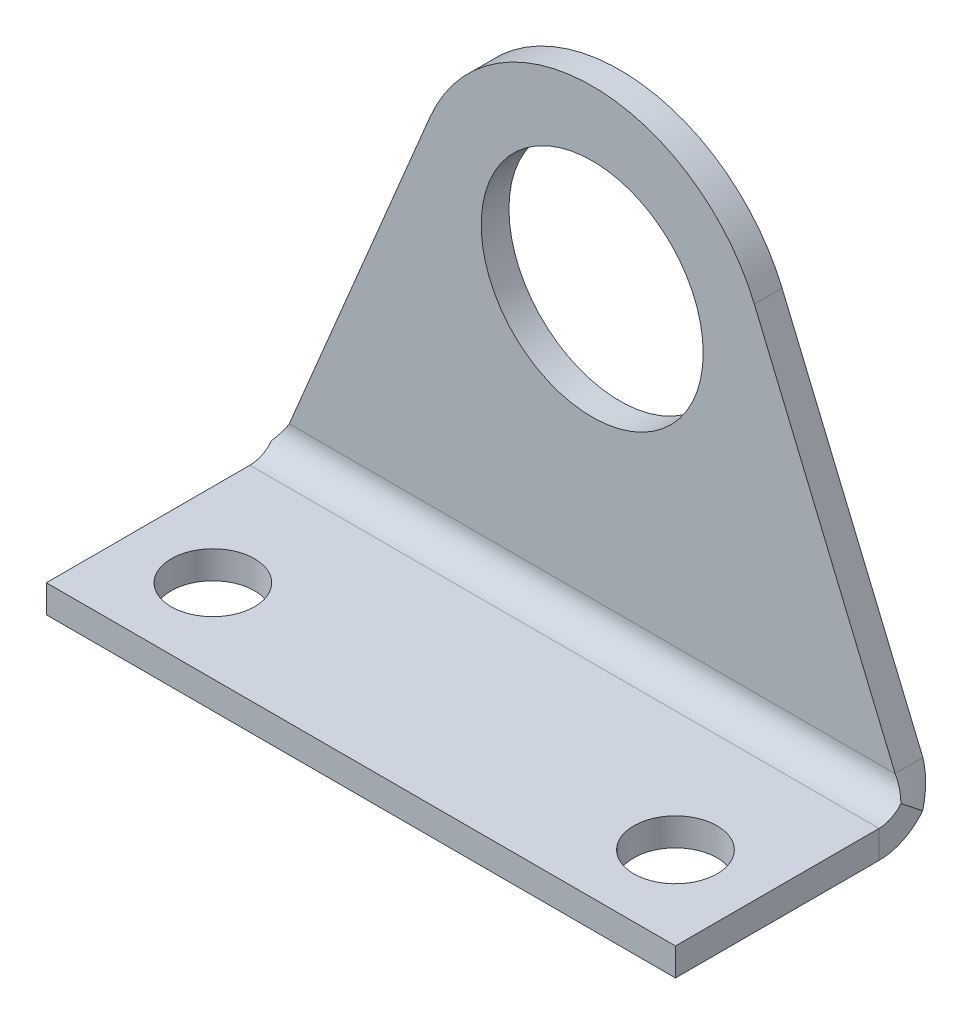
SolidWorks part; units mm, degrees
ref_plane "Plan1" through (0, 0, 0) normal (0, 0, 1) x (1, 0, 0)
ref_plane "Plan2" through (0, 0, 0) normal (0, 1, 0) x (1, 0, 0)
ref_plane "Plan3" through (0, 0, 0) normal (1, 0, 0) x (0, 0, -1)
sketch "Eflan" plane through (0, 0, 0) normal (0, 0, 1) x (1, 0, 0)
  line L0 (-8.7626, 19.6697) -> (-17, 0)
  line L1 (-17, 0) -> (17, 0)
  line L2 (17, 0) -> (8.7626, 19.6697)
  line L3 (0, 25.5) -> (17, 25.5) construction
  line L4 (0, 0) -> (0, 25.5) construction
  arc A0 (-8.7626, 19.6697) -> (8.7626, 19.6697) centre (0, 16) cw
  dimension "US" = 34
  dimension "NH" = 16
  dimension "H1" = 25.5
extrude "Flan" add sketch "Eflan" along normal blind 1.5
sketch "Eembase" plane through (0, 0, 0) normal (0, 0, -1) x (-1, 0, 0)
  line L1 (17, 0) -> (-17, 0)
  line L2 (17, 0) -> (17, -1.5)
  line L3 (17, -1.5) -> (-17, -1.5)
  line L4 (-17, 0) -> (-17, -1.5)
extrude "Embase" add sketch "Eembase" against normal blind 14
sheet metal parameters "Tôlerie 6"
bend "Pli dans angle1" bend angle 90 parameters "D1"=0, "D5"=1
flatten bends "Dépliage 7" parameters "D1"=0
sketch "Esquisse-Angle7" plane through (0, 0, 0) normal (0, 1, 0) x (-1, 0, 0)
  line L0 (-17, 1.2329) -> (17, 1.2329) construction
process bends "Pliage 7" parameters "D1"=0
sketch "Esquisse-Plate7" plane through (0, 0, 0) normal (0, 1, 0) x (-1, 0, 0)
sketch "Dnezvérin" plane through (0, 0, 1.5) normal (0, 0, 1) x (1, 0, 0)
  circle A0 centre (0, 16) radius 6
  arc A1 (8.7626, 19.6697) -> (-8.7626, 19.6697) centre (0, 16) ccw construction
  dimension "D2" = 12
extrude "Percage vérin" cut sketch "Dnezvérin" against normal through all
sketch "dfixation" plane through (0, 0, 0) normal (0, 1, 0) x (-1, 0, 0)
  line L0 (8.7626, 0) -> (16.3718, 0) construction
  line L1 (0, 0) -> (0, 14) construction
  line L2 (0, 1.5) -> (0, 0) construction
  line L3 (17, 14) -> (-17, 14) construction
  circle A0 centre (12.5, 9.5) radius 2.25
  circle A1 centre (-12.5, 9.5) radius 2.25
  dimension "AB" = 4.5
  dimension "AU" = 9.5
  dimension "TR" = 25
extrude "Percage fixation" cut sketch "dfixation" against normal through all
